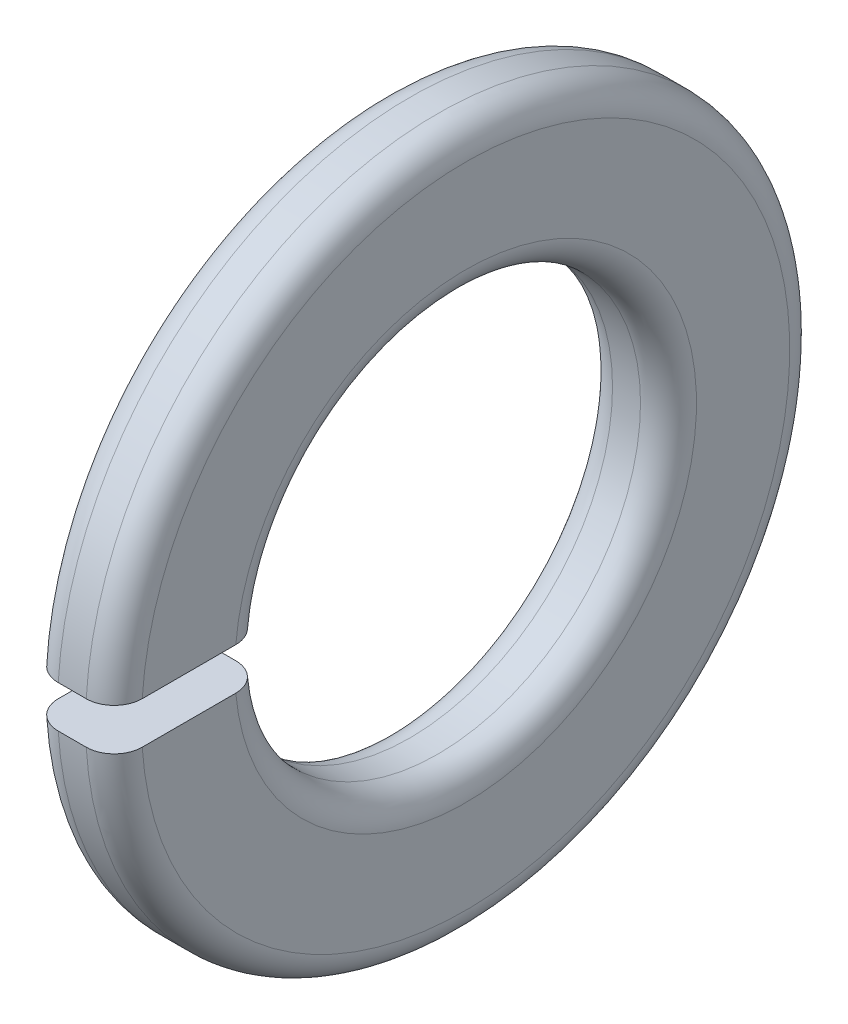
SolidWorks part; units mm, degrees
ref_plane "Plane1" through (0, 0, 0) normal (0, 0, 1) x (1, 0, 0)
ref_plane "Plane2" through (0, 0, 0) normal (0, 1, 0) x (1, 0, 0)
ref_plane "Plane3" through (0, 0, 0) normal (1, 0, 0) x (0, 0, -1)
sketch "Sketch1" plane through (0, 0, 0) normal (0, 0, 1) x (1, 0, 0)
  line L0 (-34.925, 0) -> (9.525, 0) construction
  line L1 (0, 2.475) -> (0, 3.475)
  line L2 (-0.3, 3.775) -> (-0.6, 3.775)
  line L3 (-0.9, 3.475) -> (-0.9, 2.475)
  line L4 (-0.6, 2.175) -> (-0.3, 2.175)
  arc A0 (-0.6, 2.175) -> (-0.9, 2.475) centre (-0.6, 2.475) cw
  arc A1 (0, 2.475) -> (-0.3, 2.175) centre (-0.3, 2.475) cw
  arc A2 (0, 3.475) -> (-0.3, 3.775) centre (-0.3, 3.475) ccw
  arc A3 (-0.6, 3.775) -> (-0.9, 3.475) centre (-0.6, 3.475) ccw
  point P8 (-0.9, 2.175)
  point P14 (0, 3.775)
  point P17 (-0.9, 3.775)
revolve "Base-Revolve" add sketch "Sketch1" angle 360 about L0
sketch "Sketch2" plane through (0, 0, 0) normal (-1, 0, 0) x (0, -1, 0)
  line L0 (-0.225, 0) -> (0.225, 0)
  line L1 (0, 0) -> (0, 12.7) construction
  line L2 (0.225, 0) -> (0.225, 3.8505)
  line L3 (0.225, 3.8505) -> (-0.225, 3.8505)
  line L4 (-0.225, 3.8505) -> (-0.225, 0)
extrude "Gap" cut sketch "Sketch2" along normal through all
equation "\"D1@Sketch2\" = \"Thickness@Sketch1\" * 0.5"
equation "\"D2@Sketch2\" = \"Outside_dia@Sketch1\" * 0.51"
